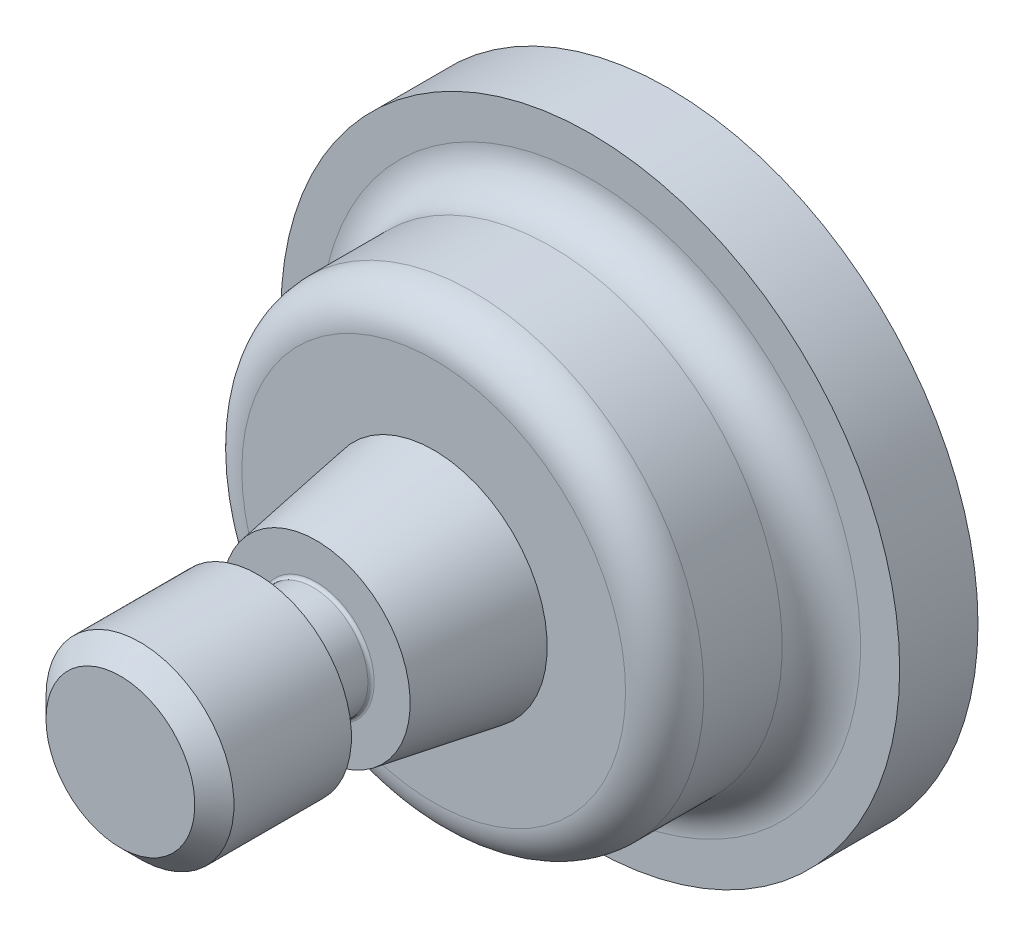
SolidWorks part; units mm, degrees
ref_plane "Plane1" through (0, 0, 0) normal (0, 0, 1) x (1, 0, 0)
ref_plane "Plane2" through (0, 0, 0) normal (0, 1, 0) x (1, 0, 0)
ref_plane "Plane3" through (0, 0, 0) normal (1, 0, 0) x (0, 0, -1)
sketch "Sketch1" plane through (0, 0, 0) normal (-1, 0, 0) x (0, 0, 1)
  line L0 (-88.9, 50.165) -> (-76.1987, 50.165)
  line L1 (-57.15, 37.4662) -> (-69.85, 37.4662)
  line L2 (-31.242, 8.89) -> (-22.733, 8.89)
  line L3 (-50.7988, 31.115) -> (-50.7988, 18.4148)
  line L4 (0, 0) -> (20.955, 0) construction
  line L5 (-50.7988, 18.4148) -> (-31.75, 15.24)
  line L6 (-22.225, 15.24) -> (-3.175, 15.24)
  line L7 (-3.175, 15.24) -> (0, 12.065)
  line L8 (0, 0) -> (0, 12.065)
  line L9 (-22.225, 15.24) -> (-22.225, 9.398)
  line L10 (-31.75, 15.24) -> (-31.75, 9.398)
  line L11 (-76.1987, 50.165) -> (-76.1987, 43.815)
  line L12 (-88.9, 50.165) -> (-88.9, 0)
  line L13 (46.4569, 0) -> (54.8389, 0) construction
  line L14 (0, 0) -> (-88.9, 0)
  arc A0 (-57.15, 37.4662) -> (-50.7988, 31.115) centre (-57.15, 31.115) cw
  arc A1 (-76.1987, 43.815) -> (-69.85, 37.4662) centre (-69.85, 43.815) ccw
  arc A2 (-22.733, 8.89) -> (-22.225, 9.398) centre (-22.733, 9.398) ccw
  arc A3 (-31.242, 8.89) -> (-31.75, 9.398) centre (-31.242, 9.398) cw
revolve "Base-Revolve" add sketch "Sketch1" angle 360 about L4
sketch "Stock Profile" plane through (0, 0, 0) normal (-1, 0, 0) x (0, 0, 1)
  line L0 (-96.52, 50.165) -> (-96.52, 0)
  line L2 (4.92, 25.875) -> (-30.502, 25.875)
  line L4 (-31.3371, 25.9441) -> (-36.5552, 26.8138)
  line L6 (-40.8, 31.8247) -> (-40.8, 45.085)
  line L8 (10, 0) -> (10, 20.795)
  line L9 (-96.52, 0) -> (10, 0)
  line L10 (-45.88, 50.165) -> (-96.52, 50.165)
  arc A0 (4.92, 25.875) -> (10, 20.795) centre (4.92, 20.795) cw
  arc A1 (-30.502, 25.875) -> (-31.3371, 25.9441) centre (-30.502, 30.955) cw
  arc A2 (-45.88, 50.165) -> (-40.8, 45.085) centre (-45.88, 45.085) cw
  arc A3 (-40.8, 31.8247) -> (-36.5552, 26.8138) centre (-35.72, 31.8247) ccw
  dimension "D5" = 5.08
  dimension "D6" = 5.08
